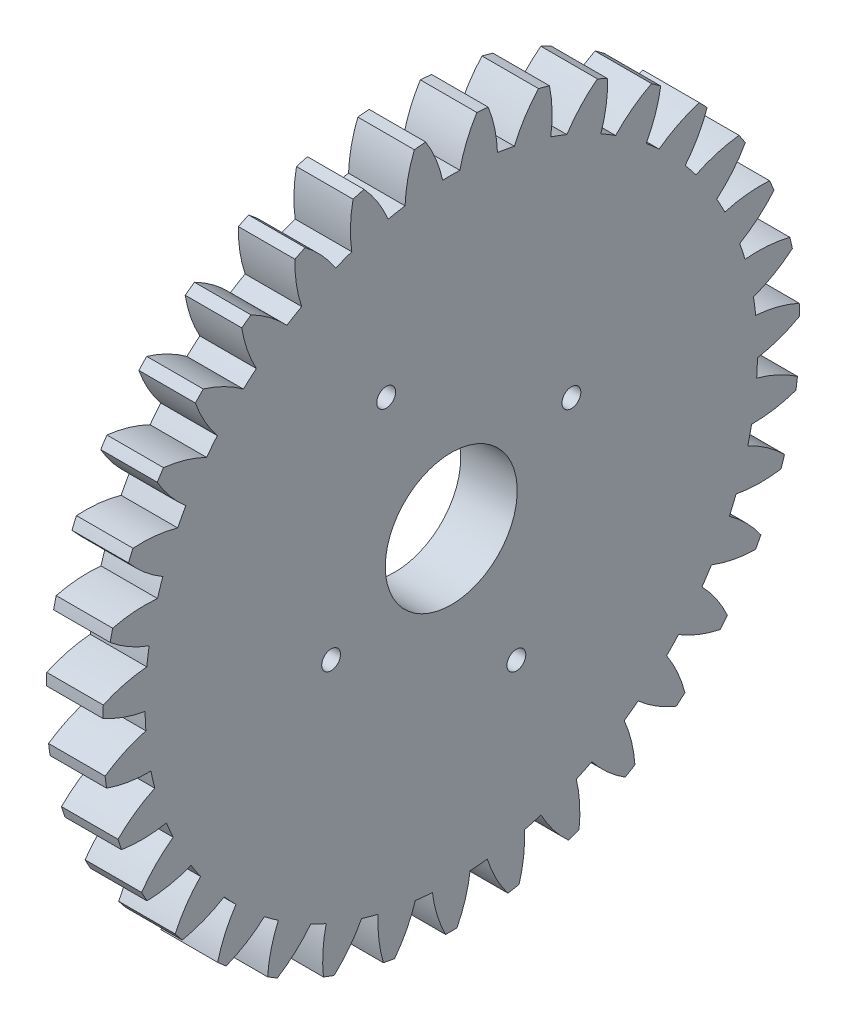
SolidWorks part; units mm, degrees
ref_plane "Plane1" through (0, 0, 0) normal (0, 0, 1) x (1, 0, 0)
ref_plane "Plane2" through (0, 0, 0) normal (0, 1, 0) x (1, 0, 0)
ref_plane "Plane3" through (0, 0, 0) normal (1, 0, 0) x (0, 0, -1)
sketch "HoldingSke" plane through (0, 0, 0) normal (0, 1, 0) x (1, 0, 0)
  line L0 (0, 0) -> (0.8192, -0.5736)
  line L1 (-15, 0) -> (100, 0) construction
  line L2 (0, 0) -> (-2.1039, 2.3779)
  line L3 (0, 0) -> (-11.863, 4.5341)
  line L4 (0, 0) -> (7.0742, 4.9534)
  line L5 (0, 0) -> (-46.8476, -17.4728)
  line L6 (0, 0) -> (-2.4869, -1.6779)
  line L7 (-2.1039, 2.3779) -> (8.6586, 51.2059)
  line L8 (-76.2, 54.61) -> (-75.2, 54.61)
  line L9 (-71.009, 38.7566) -> (-53.1078, 45.2721)
  line L10 (-76.2, 71.12) -> (104.1128, 71.12)
  line L11 (0, 0) -> (-3, 0)
  line L12 (-76.2, 101.6) -> (-76.162, 101.6)
  line L13 (24.9733, 27.94) -> (52.9518, 28.4284)
  line L14 (24.9733, 27.94) -> (24.9743, 27.94)
  line L15 (24.9733, 27.94) -> (100.4006, 29.5858)
  line L16 (-63.627, -1) -> (-12.827, -1)
  circle A0 centre (0, 0) radius 3.5
  circle A1 centre (0, 0) radius 16.249
  circle A2 centre (0, 0) radius 37.5
  circle A3 centre (0, 0) radius 3.5
sketch "BasProSke" plane through (0, 0, 0) normal (0, 1, 0) x (1, 0, 0)
  line L0 (-10, 0) -> (60, 0) construction
  line L1 (0, 0) -> (0, 18.5)
  line L2 (0, 0) -> (3, 0)
  line L3 (3, 0) -> (3, 18.5)
  line L4 (3, 18.5) -> (0, 18.5)
revolve "Base-Revolve" add sketch "BasProSke" angle 360 about L0
sketch "TooCutSke" plane through (0, 0, 0) normal (1, 0, 0) x (0, 0, -1)
  line L1 (0, 0) -> (0, 107) construction
  line L2 (0, 0) -> (-0.8516, 17.4793) construction
  line L3 (0, 0) -> (-3.1347, 34.8297) construction
  line L4 (-0.8516, 17.4793) -> (-1.5674, 17.4148) construction
  arc A0 (0.4564, 16.2426) -> (-0.4564, 16.2426) centre (0, 0) ccw
  arc A1 (1.373, 18.4745) -> (-1.373, 18.4745) centre (0, 0) ccw
  circle A2 centre (0, 0) radius 17.5 construction
  circle A3 centre (0, 0) radius 16.4446 construction
  arc A4 (-0.4564, 16.2426) -> (-1.373, 18.4745) centre (-7.293, 14.739) ccw
  arc A5 (1.373, 18.4745) -> (0.4564, 16.2426) centre (7.293, 14.739) ccw
extrude "ToothCut" cut sketch "TooCutSke" along normal through all
fillet "Breaks" [suppressed] radius 0.02
fillet "RootFillets" [suppressed] radius 0.251
pattern_circular "TeethCuts" count 35 every 10.286 about axis through (-10, 0, 0) along (1, 0, 0) of "ToothCut", "RootFillets", "Breaks"
sketch "HubNeaOneSke" plane through (0, 0, 0) normal (-1, 0, 0) x (0, 0, 1)
  circle A0 centre (0, 0) radius 16.249
extrude "HubNearOne" [suppressed] add sketch "HubNeaOneSke" along normal blind 47.0001
sketch "HubNeaBotSke" plane through (0, 0, 0) normal (-1, 0, 0) x (0, 0, 1)
  circle A0 centre (0, 0) radius 16.249
extrude "HubNearBoth" [suppressed] add sketch "HubNeaBotSke" along normal blind 23.5
ref_plane "FarPln" through (3, 0, 0) normal (1, 0, 0) x (0, 0, -1)
sketch "HubFarSke" plane through (3, 0, 0) normal (1, 0, 0) x (0, 0, -1)
  circle A0 centre (0, 0) radius 16.249
extrude "HubFar" [suppressed] add sketch "HubFarSke" along normal blind 23.5
sketch "BorSke" plane through (0, 0, 0) normal (1, 0, 0) x (0, 0, -1)
  circle A0 centre (0, 0) radius 3.5
extrude "Bore" cut sketch "BorSke" along normal mid plane 100.0001
sketch "KeySke" plane through (0, 0, 0) normal (1, 0, 0) x (0, 0, -1)
  line L0 (-1, 0) -> (-1, 4.5)
  line L1 (-1, 4.5) -> (1, 4.5)
  line L2 (1, 4.5) -> (1, 0)
  line L3 (0, 0) -> (0, 34) construction
  line L4 (-1, 0) -> (1, 0)
extrude "Keyway" [suppressed] cut sketch "KeySke" along normal mid plane 100.0001
pattern_circular "Keyway2" [suppressed] count 2 every 90 about axis through (-10, 0, 0) along (1, 0, 0)
hole_wizard "Ø1.0mm Clearance Dowel Hole1" positions "Sketch1" profile "Sketch2" hole size "Ø1.0" standard "ISO"
sketch "Sketch1" plane through (3, 14.5205, -34.5746) normal (1, 0, 0) x (0, 0.922, 0.3872)
  point P0 (-0.1463, 44.4762)
  point P3 (8.4981, 37.6782)
  point P6 (0.1463, 30.5238)
  point P9 (-8.4981, 37.3218)
sketch "Sketch2" plane through (3, -2.8362, 6.3753) normal (0, 1, 0) x (0, 0, -1)
  line L0 (0, 0) -> (0, 3)
  line L1 (0, 3) -> (0.5, 3)
  line L2 (0.5, 3) -> (0.5, 0)
  line L3 (0.5, 0) -> (0, 0)
  line L4 (0, -6.35) -> (0, 107.95) construction
  dimension "Thru Hole Dia." = 1
  dimension "Thru Hole Depth" = 3
equation "' \"Module@HoldingSke\" = 6.35"
equation "' \"Num_teeth@HoldingSke\" = 12"
equation "' \"Ap@HoldingSke\" =  20"
equation "' \"Ap@HoldingSke\" = 20"
equation "' \"Width@HoldingSke\" = 0.5 * 25.4"
equation "' \"Hub_dia@HoldingSke\"= 1 * 25.4"
equation "' \"Hub_dia@HoldingSke\" = 1 * 25.4"
equation "' \"Overall_len@HoldingSke\" = 1.0 * 25.4"
equation "' \"Bore@HoldingSke\" = 0.75 * 25.4"
equation "' \"T_dim@HoldingSke\" = 0.1 * 25.4"
equation "' \"Width@KeySke\" = 0.25 * 25.4"
equation "' \"Show_teeth@HoldingSke\" = 13"
equation "' \"Backlash@HoldingSke\" = 0.009 * 25.4"
equation "' \"Addendum_fac@HoldingSke\" = 1.0"
equation "' \"Dedendum_fac@HoldingSke\" = 1.25"
equation "' \"Dedendum_add@HoldingSke\" = 0.00005 * 25.4"
equation "' \"Clearance_fac@HoldingSke\" = 0.25"
equation "\"Pitch@HoldingSke\" = 1 / \"Module@HoldingSke\""
equation "\"Overcut_dia@TooCutSke\" = (\"Num_teeth@HoldingSke\" + 2 * \"Addendum_fac@HoldingSke\") / \"Pitch@HoldingSke\" + 0.002 * 25.4"
equation "\"Pitch_dia@TooCutSke\" = \"Num_teeth@HoldingSke\" / \"Pitch@HoldingSke\""
equation "\"Base_dia@TooCutSke\" = \"Num_teeth@HoldingSke\" / \"Pitch@HoldingSke\" * cos((\"Ap@HoldingSke\"  * 3.14159265 / 180))"
equation "\"Root_dia@TooCutSke\" = (\"Num_teeth@HoldingSke\" + 2) / \"Pitch@HoldingSke\" - 2 * (\"Addendum_fac@HoldingSke\" + \"Dedendum_fac@HoldingSke\") / \"Pitch@HoldingSke\" - \"Dedendum_add@HoldingSke\" * 2"
equation "\"Half_ang@TooCutSke\" = 180 / \"Num_teeth@HoldingSke\""
equation "\"Half_CT@TooCutSke\" = \"Num_teeth@HoldingSke\" / \"Pitch@HoldingSke\" * sin((3.14159265 / 2 / \"Num_teeth@HoldingSke\")) / 2 - 7 * \"Backlash@HoldingSke\" / 4"
equation "\"Flank_rad@TooCutSke\" = \"Num_teeth@HoldingSke\" / \"Pitch@HoldingSke\" / 5"
equation "\"Radius@RootFillets\" = \"Clearance_fac@HoldingSke\" / \"Pitch@HoldingSke\" + \"Dedendum_add@HoldingSke\""
equation "\"Break_rad@Breaks\" = 0.02 / \"Pitch@HoldingSke\""
equation "\"Thickness@HoldingSke\" = \"Width@HoldingSke\""
equation "\"OAL@HoldingSke\" = \"Thickness@HoldingSke\""
equation "\"MHD@HoldingSke\" = (\"Num_teeth@HoldingSke\" + 2) / \"Pitch@HoldingSke\" - 2 * (\"Addendum_fac@HoldingSke\" + \"Dedendum_fac@HoldingSke\")  / \"Pitch@HoldingSke\" - \"Dedendum_add@HoldingSke\" * 2"
equation "\"MBD@HoldingSke\" = (\"Num_teeth@HoldingSke\" + 2) / \"Pitch@HoldingSke\" - 2 * (\"Addendum_fac@HoldingSke\" + \"Dedendum_fac@HoldingSke\")  / \"Pitch@HoldingSke\" - \"Dedendum_add@HoldingSke\" * 2 - 0.002 * 25.4"
equation "\"MHD@HoldingSke\" = ((sgn( \"MHD@HoldingSke\" - \"Hub_dia@HoldingSke\" )-1)*( \"MHD@HoldingSke\" - \"Hub_dia@HoldingSke\" ))/-2+ \"Hub_dia@HoldingSke\""
equation "\"MBD@HoldingSke\" = ((sgn( \"MBD@HoldingSke\" - \"Bore@HoldingSke\" )-1)*( \"MBD@HoldingSke\" - \"Bore@HoldingSke\" ))/-2+ \"Bore@HoldingSke\""
equation "\"OAL@HoldingSke\" = ((sgn( \"OAL@HoldingSke\" - \"Overall_len@HoldingSke\" )+1)*( \"OAL@HoldingSke\" - \"Overall_len@HoldingSke\" ))/2 + \"Overall_len@HoldingSke\" + 0.000002 * 25.4"
equation "\"Num_teeth@TeethCuts\" = int( \"Show_teeth@HoldingSke\" ) + 1"
equation "\"Num_teeth@TeethCuts\" = ((sgn( \"Num_teeth@TeethCuts\" - \"Num_teeth@HoldingSke\" )-1)*( \"Num_teeth@TeethCuts\" - \"Num_teeth@HoldingSke\" ))/-2+ \"Num_teeth@HoldingSke\""
equation "\"Num_teeth@TeethCuts\" = ((sgn( \"Num_teeth@TeethCuts\" - 2.0)+1)*( \"Num_teeth@TeethCuts\" - 2.0))/2 +2.0"
equation "\"Angle@TeethCuts\" = 360.0 / \"Num_teeth@HoldingSke\""
equation "\"Diameter@BasProSke\" = (\"Num_teeth@HoldingSke\" + 2 * \"Addendum_fac@HoldingSke\") / \"Pitch@HoldingSke\""
equation "\"Thickness@BasProSke\"  = \"Thickness@HoldingSke\""
equation "' \"Fillet_rad@BasProSke\" =  \"Thickness@HoldingSke\" * 0.05"
equation "' \"Fillet_rad@BasProSke\" = \"Thickness@HoldingSke\" * 0.05"
equation "\"MHD@HoldingSke\" = ((sgn( \"MHD@HoldingSke\" - \"Root_dia@TooCutSke\" )-1)*( \"MHD@HoldingSke\" - \"Root_dia@TooCutSke\" ))/-2+ \"Root_dia@TooCutSke\""
equation "\"Diameter@HubNeaOneSke\" = \"MHD@HoldingSke\""
equation "\"Length@HubNearOne\" = \"OAL@HoldingSke\" - \"Thickness@BasProSke\""
equation "\"Diameter@HubNeaBotSke\" = \"MHD@HoldingSke\""
equation "\"Length@HubNearBoth\" = ( \"OAL@HoldingSke\" - \"Thickness@BasProSke\" ) / 2.0"
equation "\"Thickness@FarPln\" = \"Thickness@BasProSke\""
equation "\"Diameter@HubFarSke\" = \"MHD@HoldingSke\""
equation "\"Length@HubFar\" = ( \"OAL@HoldingSke\" - \"Thickness@BasProSke\" ) / 2.0"
equation "\"Diameter@BorSke\" = \"MBD@HoldingSke\""
equation "\"D1@Bore\" = \"OAL@HoldingSke\" * 2.0"
equation "\"D1@Keyway\" = \"OAL@HoldingSke\" * 2.0"
equation "\"Offset@KeySke\" = \"T_dim@HoldingSke\" + \"MBD@HoldingSke\" / 2.0"
